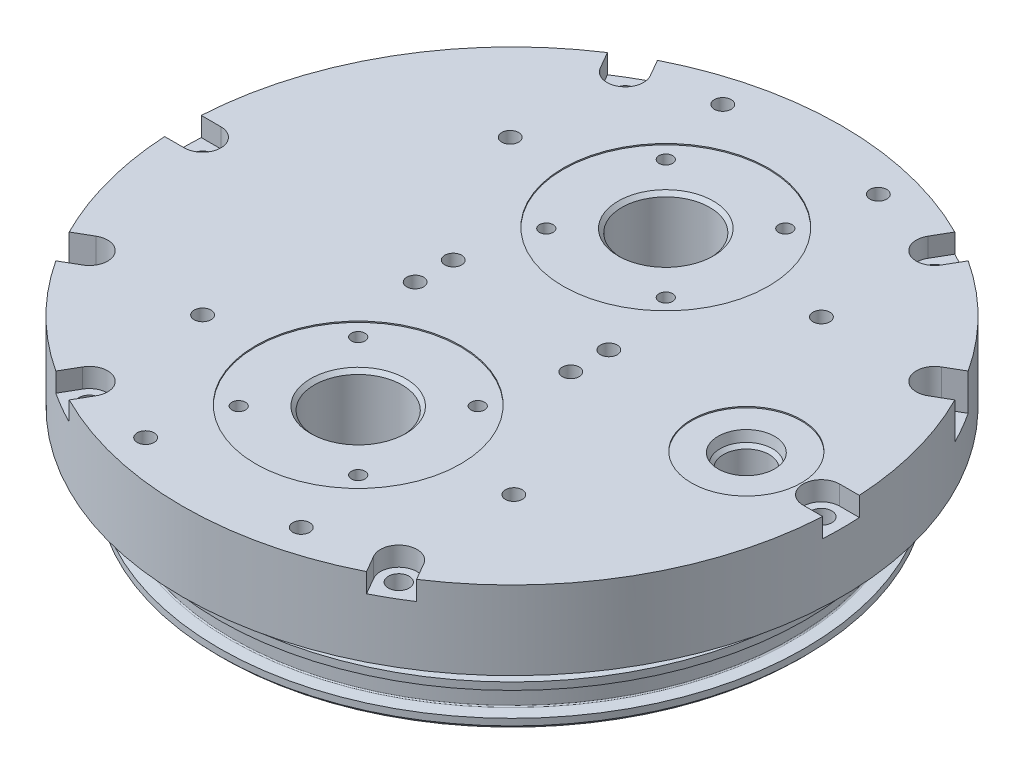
SolidWorks part; units mm, degrees
ref_plane "Front" through (0, 0, 0) normal (0, 0, 1) x (1, 0, 0)
ref_plane "Top" through (0, 0, 0) normal (0, 1, 0) x (1, 0, 0)
ref_plane "Right" through (0, 0, 0) normal (1, 0, 0) x (0, 0, -1)
sketch "Sketch1" plane through (0, 0, 0) normal (0, 1, 0) x (1, 0, 0)
  circle A0 centre (0, 0) radius 71.4375
  dimension "D1" = 142.875
extrude "Extrude1" add sketch "Sketch1" along normal blind 17.018
sketch "Sketch2" plane through (0, 0, 0) normal (0, -1, 0) x (1, 0, 0)
  circle A0 centre (0, 0) radius 63.4619
  dimension "D1" = 126.9238
extrude "Extrude2" add sketch "Sketch2" along normal blind 15.875
ref_plane "Plane1" through (0, -13.97, 0) normal (-1, 0, 0) x (0, 0, 1)
ref_plane "Plane2" through (0, -13.97, 0) normal (-1, 0, 0) x (0, 0, 1)
ref_plane "Plane3" through (0, -13.97, 0) normal (-1, 0, 0) x (0, 0, 1)
ref_plane "Plane4" through (0, -13.97, 0) normal (-1, 0, 0) x (0, 0, 1)
ref_plane "Plane5" through (0, -13.97, 0) normal (-1, 0, 0) x (0, 0, 1)
sketch "Sketch12" plane through (0, -13.97, 0) normal (-1, 0, 0) x (0, 0, 1)
  line L0 (63.4619, 12.3825) -> (63.4619, 7.146)
  line L1 (60.9125, 12.1595) -> (60.6806, 12.1392) construction
  line L2 (60.9125, 7.3691) -> (60.6806, 7.3894) construction
  line L3 (60.6806, 7.6221) -> (60.6806, 7.3894) construction
  line L4 (0, 50) -> (0, -50) construction
  line L5 (63.4619, 12.3825) -> (63.4619, 16.1311) construction
  line L6 (63.4619, 12.3825) -> (67.565, 12.3825) construction
  line L7 (-71.4375, 13.97) -> (71.4375, 13.97) construction
  line L8 (60.9125, 12.1595) -> (63.4619, 12.3825)
  line L9 (60.6806, 11.9064) -> (60.6806, 12.1392) construction
  line L10 (63.4619, 7.146) -> (60.9125, 7.3691)
  line L11 (60.6806, 7.6221) -> (60.6806, 11.9064)
  line L12 (63.4619, 12.3825) -> (63.4619, 16.6216) construction
  line L13 (63.4619, -1.905) -> (63.4619, 13.97) construction
  line L14 (-60.6806, 7.6221) -> (-60.6806, 11.9064) construction
  line L15 (60.6806, 11.9064) -> (63.4619, 11.9064) construction
  line L16 (60.6806, 7.6221) -> (63.4619, 7.6221) construction
  arc A2 (60.9125, 7.3691) -> (60.6806, 7.6221) centre (60.9346, 7.6221) cw
  arc A3 (60.6806, 11.9064) -> (60.9125, 12.1595) centre (60.9346, 11.9064) cw
  dimension "D5" = 0.254
  dimension "D1" = 1.5875
  dimension "D2" = 4.7498
  dimension "D3" = 5
  dimension "D4" = 121.3612
  dimension "D6" = 5
revolve "Groove for AS 568-248, O-Ring2" cut sketch "Sketch12"
sketch "Sketch8" plane through (0, -13.97, 0) normal (-1, 0, 0) x (0, 0, 1)
  line L0 (-60.6806, 0.7982) -> (-60.6806, 5.0825) construction
  line L1 (63.4619, -1.905) -> (63.4619, 7.146) construction
  line L2 (60.6806, 5.0825) -> (63.4619, 5.0825) construction
  line L3 (60.6806, 0.7982) -> (63.4619, 0.7982) construction
  line L4 (0, 50) -> (0, -50) construction
  line L5 (60.9125, 5.3355) -> (60.6806, 5.3152) construction
  line L6 (60.9125, 5.3355) -> (63.4619, 5.5585)
  line L7 (63.4619, 5.5585) -> (63.4619, 0.3221)
  line L8 (63.4619, 0.3221) -> (60.9125, 0.5451)
  line L9 (60.6806, 0.7982) -> (60.6806, 5.0825)
  line L10 (60.6806, 5.0825) -> (60.6806, 5.3152) construction
  line L11 (60.6806, 0.7982) -> (60.6806, 0.5654) construction
  line L12 (60.9125, 0.5451) -> (60.6806, 0.5654) construction
  arc A2 (60.9125, 0.5451) -> (60.6806, 0.7982) centre (60.9346, 0.7982) cw
  arc A3 (60.6806, 5.0825) -> (60.9125, 5.3355) centre (60.9346, 5.0825) cw
  dimension "D2" = 0.254
  dimension "D1" = 1.5875
  dimension "D3" = 121.3612
  dimension "D4" = 4.7498
  dimension "D5" = 5
  dimension "D6" = 5
  dimension "D7" = 5.2365
revolve "Groove for AS 568-248, O-Ring1" cut sketch "Sketch8" angle 360 about L4
chamfer "Chamfer2" distance 0.7937 angle 45 1 edges at (0, -15.875, -63.4619)
sketch "Sketch13" plane through (0, -15.875, 0) normal (0, -1, 0) x (1, 0, 0)
  circle A0 centre (0, 0) radius 57.15
  dimension "D1" = 114.3
extrude "Cut-Extrude1" cut sketch "Sketch13" against normal up to surface (15.875 mm away)
fillet "Fillet2" radius 3.175 1 edges at (0, 0, 57.15)
sketch "Sketch15" plane through (0, 17.018, 0) normal (0, 1, 0) x (-1, 0, 0)
  circle A0 centre (0, -33.3375) radius 9.525
  circle A1 centre (0, 33.3375) radius 9.525
  dimension "D1" = 19.05
  dimension "D3" = 33.3375
  dimension "D2" = 33.3375
extrude "MinK" cut sketch "Sketch15" against normal through all
sketch "Sketch14" plane through (0, 17.018, 0) normal (0, 1, 0) x (-1, 0, 0)
  line L0 (0, -33.3375) -> (-28.6258, -33.3375) construction
  circle A0 centre (0, -33.3375) radius 22.225
  circle A1 centre (0, -33.3375) radius 22.225 construction
  circle A2 centre (0, 33.3375) radius 22.225
  dimension "D1" = 44.45
extrude "Spot Face" cut sketch "Sketch14" against normal blind 0.254
chamfer "Chamfer1" distance 0.7937 angle 45 2 edges at (0, 16.764, -23.8125) (0, 16.764, 42.8625)
hole_wizard "#6-32 Tapped Hole1" positions "Sketch27" profile "Sketch26" tap size "#6-32" standard "Ansi Inch"
sketch "Sketch27" plane through (0, 16.764, 0) normal (0, 1, 0) x (-1, 0, 0)
  point P0 (-12.954, -46.2915)
  point P2 (-12.954, -20.3835)
  point P4 (12.954, -20.3835)
  point P6 (12.954, -46.2915)
  point P7 (-12.954, 20.3835)
  point P9 (-12.954, 46.2915)
  point P11 (12.954, 46.2915)
  point P13 (12.954, 20.3835)
  dimension "D1" = 12.954
  dimension "D2" = 12.954
  dimension "D3" = 12.954
  dimension "D4" = 12.954
  dimension "D5" = 12.954
  dimension "D6" = 12.954
sketch "Sketch26" plane through (12.954, 16.764, -46.2915) normal (1, 0, 0) x (0, 0, 1)
  line L0 (0, 0) -> (0, 10.2832)
  line L1 (0, 10.2832) -> (1.4732, 9.398)
  line L2 (1.4732, 9.398) -> (1.4732, 0)
  line L5 (1.4732, 0) -> (0, 0)
  line L10 (0, 10.2832) -> (-1.4732, 9.398) construction
  line L11 (0, -6.35) -> (0, 107.95) construction
  dimension "Tap Drill Dia." = 2.9464
  dimension "Tap Drill Depth" = 9.398
  dimension "Drill Angle" = 118
hole_wizard "SAE#4" positions "Sketch210" profile "Sketch3" legacy
sketch "Sketch210" plane through (64.9843, 17.018, 64.0752) normal (0, 1, 0) x (-1, 0, 0)
  line L0 (64.9843, -64.0752) -> (14.1843, -64.0752) construction
  circle A0 centre (64.9843, -64.0752) radius 50.8 construction
  point P0 (14.1843, -64.0752)
  dimension "D1" = 101.6
sketch "Sketch3" plane through (50.8, 17.018, 0) normal (1, 0, 0) x (0, 0, 1)
  line L0 (0, 0) -> (0, 13.8938)
  line L1 (0, 13.8938) -> (4.9606, 13.8938)
  line L2 (4.9606, 13.8938) -> (4.9606, 3.0844)
  line L3 (5.6828, 2.3622) -> (6.1849, 0)
  line L4 (6.1849, 0) -> (0, 0)
  line L5 (0, -6.4453) -> (0, 42.3633) construction
  line L6 (-5.5563, 2.9576) -> (-6.1849, 0) construction
  line L7 (4.9606, 3.0844) -> (5.6828, 2.3622)
  line L9 (-71.4375, 0) -> (71.4375, 0) construction
  dimension "Diameter" = 9.9212
  dimension "Depth" = 13.8938
  dimension "C-Sink Angle" = 24
  dimension "C-Sink Diameter" = 12.3698
sketch "Sketch5" plane through (-46.2806, 3.1242, -6.3201) normal (0, 1, 0) x (-1, 0, 0)
  circle A0 centre (-97.0806, 6.3201) radius 2.1844
  dimension "D1" = 4.3688
extrude "Thru hole.172" cut sketch "Sketch5" against normal through all
other "SAE#4-Port<1>"
sketch "Sketch211" plane through (0, 17.018, 0) normal (0, 1, 0) x (1, 0, 0)
  circle A0 centre (50.8, 0) radius 11.9062
  dimension "D1" = 23.8125
extrude "SpotFace" cut sketch "Sketch211" against normal blind 0.254
hole_wizard "CBORE for #8 Socket Head Cap Screw1" positions "Sketch17" profile "Sketch16" counterbore size "#8" standard "Ansi Inch"
sketch "Sketch17" plane through (0, 17.018, 0) normal (0, 1, 0) x (-1, 0, 0)
  line L0 (0, 0) -> (-71.4375, 0) construction
  circle A0 centre (0, 0) radius 71.4375 construction
  circle A1 centre (0, 0) radius 67.0719 construction
  point P8 (-67.0719, 0)
  dimension "D1" = 134.1438
sketch "Sketch16" plane through (67.0719, 17.018, 0) normal (1, 0, 0) x (0, 0, 1)
  line L0 (0, 0) -> (0, 32.893)
  line L1 (0, 32.893) -> (2.2479, 32.893)
  line L3 (2.2479, 32.893) -> (2.2479, 4.1656)
  line L4 (2.2479, 4.1656) -> (3.9687, 4.1656)
  line L5 (3.9687, 4.1656) -> (3.9687, 0)
  line L7 (3.9687, 0) -> (0, 0)
  line L11 (0, -6.35) -> (0, 107.95) construction
  dimension "Thru Hole Dia." = 4.4958
  dimension "Thru Hole Depth" = 32.893
  dimension "C'Bore Dia." = 7.9375
  dimension "C'Bore Depth" = 4.1656
sketch "Sketch215" plane through (0, 17.018, 0) normal (0, 1, 0) x (1, 0, 0)
  line L0 (67.0719, 3.9688) -> (82.6468, 3.9688)
  line L1 (67.0719, -3.9687) -> (82.6468, -3.9687)
  line L2 (82.6468, -3.9687) -> (82.6468, 3.9688)
  circle A0 centre (67.0719, 0) radius 3.9687 construction
  arc A1 (67.0719, 3.9688) -> (67.0719, -3.9687) centre (67.0719, 0) ccw
extrude "Cut-Extrude2" cut sketch "Sketch215" against normal up to surface (4.1656 mm away)
pattern_circular "CirPattern1" count 6 over 360 about axis through (0, 0, 0) along (0, 1, 0) of "CBORE for #8 Socket Head Cap Screw1", "Cut-Extrude2"
hole_wizard "#8-32 Tapped Jacking bolts" positions "Sketch31" profile "Sketch30" tap size "#8-32" standard "Ansi Inch"
sketch "Sketch31" plane through (0, 17.018, 0) normal (0, 1, 0) x (-1, 0, 0)
  line L0 (58.0832, 33.5343) -> (-58.0832, -33.5343) construction
  line L1 (0, 0) -> (74.5619, 0) construction
  circle A0 centre (0, 0) radius 67.0687 construction
  point P0 (58.0832, 33.5343)
  point P1 (-58.0832, -33.5343)
  dimension "D2" = 134.1374
  dimension "D1" = 30
sketch "Sketch30" plane through (-58.0832, 17.018, 33.5343) normal (1, 0, 0) x (0, 0, 1)
  line L0 (0, 0) -> (0, 32.893)
  line L1 (0, 32.893) -> (1.8288, 32.893)
  line L2 (1.8288, 32.893) -> (1.8288, 0)
  line L5 (1.8288, 0) -> (0, 0)
  line L11 (0, -6.35) -> (0, 107.95) construction
  dimension "Thru Tap Drill Dia." = 3.6576
  dimension "Thru Tap Drill Depth" = 32.893
sketch "Sketch218" plane through (0, 17.018, 0) normal (0, 1, 0) x (1, 0, 0)
  line L0 (-73.0583, -37.5975) -> (-60.0676, -30.0973)
  line L1 (-70.2907, -45.1651) -> (-56.0988, -36.9714)
  line L2 (-70.2907, -45.1651) -> (-73.0583, -37.5975)
  line L3 (70.7512, 36.2655) -> (70.5565, 45.3185)
  line L4 (56.0988, 36.9714) -> (70.5565, 45.3185)
  line L5 (60.0676, 30.0973) -> (70.7512, 36.2655)
  arc A0 (-56.0988, -36.9714) -> (-60.0676, -30.0973) centre (-58.0832, -33.5343) ccw
  arc A1 (56.0988, 36.9714) -> (60.0676, 30.0973) centre (58.0832, 33.5343) ccw
  dimension "D1" = 7.9375
extrude "#8 CNTR BORE" cut sketch "Sketch218" against normal blind 7.9375
hole_wizard "#8-32 B-Tapped ChassisMounts" positions "Sketch29" profile "Sketch28" tap size "#8-32" standard "Ansi Inch"
sketch "Sketch29" plane through (0, 0, 0) normal (0, -1, 0) x (1, 0, 0)
  point P0 (-28.575, 34.925)
  point P1 (-28.575, -34.925)
  point P5 (15.875, 34.925)
  point P7 (15.875, -34.925)
  dimension "D1" = 28.575
  dimension "D2" = 34.925
  dimension "D3" = 34.925
  dimension "D4" = 15.875
sketch "Sketch28" plane through (-28.575, 0, 34.925) normal (1, 0, 0) x (0, 0, -1)
  line L0 (0, 0) -> (0, 11.8177)
  line L1 (0, 11.8177) -> (1.8288, 10.7188)
  line L2 (1.8288, 10.7188) -> (1.8288, 0)
  line L5 (1.8288, 0) -> (0, 0)
  line L10 (0, 11.8177) -> (-1.8288, 10.7188) construction
  line L11 (0, -6.35) -> (0, 107.95) construction
  dimension "Tap Drill Dia." = 3.6576
  dimension "Tap Drill Depth" = 10.7188
  dimension "Drill Angle" = 118
hole_wizard "1/4-28 Tapped Hole1" positions "3DSketch3" profile "Sketch25" tap size "1/4-28" standard "Ansi Inch"
sketch3d "3DSketch3"
  line L0 (-70.3676, 10.668, -12.3174) -> (-70.3676, 17.1188, -12.3174) construction
  point P0 (-70.3676, 10.668, -12.3174)
sketch "Sketch25" plane through (-70.3676, 10.668, -12.3174) normal (0, 1, 0) x (-0.1724, 0, 0.985)
  line L0 (0, 0) -> (0, 14.389)
  line L1 (0, 14.389) -> (2.8067, 12.7025)
  line L2 (2.8067, 12.7025) -> (2.8067, 0)
  line L5 (2.8067, 0) -> (0, 0)
  line L10 (0, 14.389) -> (-2.8067, 12.7025) construction
  line L11 (0, -6.35) -> (0, 107.95) construction
  dimension "Tap Drill Dia." = 5.6134
  dimension "Tap Drill Depth" = 12.7025
  dimension "Drill Angle" = 118
pattern_circular "CirPattern2" count 3 every 340 about axis through (0, 0, 0) along (0, 1, 0) of "1/4-28 Tapped Hole1"
hole_wizard "#8-32 Tapped Hole-BSR" positions "Sketch214" profile "Sketch213" tap size "#8-32" standard "Ansi Inch"
sketch "Sketch214" plane through (0, 17.018, 0) normal (0, 1, 0) x (-1, 0, 0)
  line L0 (-33.7312, -33.3375) -> (0, -33.3375) construction
  circle A0 centre (0, -33.3375) radius 33.7312 construction
  point P0 (-33.7312, -33.3375)
  dimension "D1" = 67.4624
sketch "Sketch213" plane through (33.7312, 17.018, -33.3375) normal (1, 0, 0) x (0, 0, 1)
  line L0 (0, 0) -> (0, 11.8177)
  line L1 (0, 11.8177) -> (1.8288, 10.7188)
  line L2 (1.8288, 10.7188) -> (1.8288, 0)
  line L5 (1.8288, 0) -> (0, 0)
  line L10 (0, 11.8177) -> (-1.8288, 10.7188) construction
  line L11 (0, -6.35) -> (0, 107.95) construction
  dimension "Tap Drill Dia." = 3.6576
  dimension "Tap Drill Depth" = 10.7188
  dimension "Drill Angle" = 118
pattern_circular "CirPattern3" count 6 over 360 about axis through (0, 0, -33.3375) along (0, 1, 0) of "#8-32 Tapped Hole-BSR"
mirror "Mirror1" about plane through (0, 0, 0) normal (0, 0, 1) of "CirPattern3", "#8-32 Tapped Hole-BSR"
